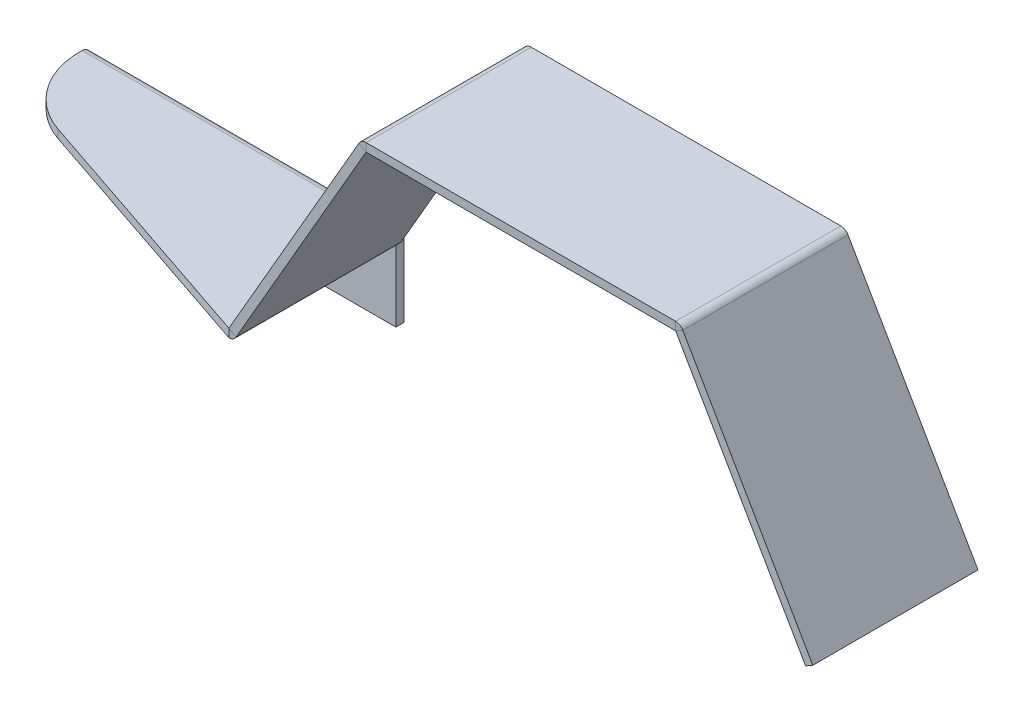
SolidWorks part; units mm, degrees
ref_plane "Front Plane" through (0, 0, 0) normal (0, 0, 1) x (1, 0, 0)
ref_plane "Top Plane" through (0, 0, 0) normal (0, 1, 0) x (1, 0, 0)
ref_plane "Right Plane" through (0, 0, 0) normal (1, 0, 0) x (0, 0, -1)
sketch "Sketch1" plane through (0, 0, 0) normal (0, 0, 1) x (1, 0, 0)
  line L0 (0, 0) -> (102, 0)
  line L1 (102, 0) -> (102, 20)
  line L2 (102, 20) -> (0, 20)
  line L3 (0, 0) -> (0, -10)
  line L4 (0, -10) -> (-28, -10)
  line L5 (-28, -10) -> (-28, 0) construction
  line L6 (0, 20) -> (-31.1966, 9.4753)
  line L7 (0, 0) -> (0, 20) construction
  line L8 (0, 0) -> (-28, 0) construction
  line L9 (0, -5) -> (-28, -5) construction
  arc A0 (-31.1966, 9.4753) -> (-28, -10) centre (-28, 0) ccw
  circle A1 centre (-8, -5) radius 1.75
  circle A2 centre (-28, -5) radius 1.75
  dimension "D3" = 10
  dimension "D5" = 8
  dimension "D6" = 3.5
  dimension "D1" = 20
  dimension "D2" = 102
  dimension "D4" = 28
sheet metal parameters "Sheet-Metal1" thickness 1 parameters "D1"=0.7366
base flange "Base-Flange1" sketch "Sketch1" thickness 1 reverse thickness direction no parameters "D1"=0.7366
sketch "Sketch3" plane through (0, 0, 0) normal (0, 0, 1) x (1, 0, 0)
  line L0 (0, 0) -> (-34.1727, 0)
sketched bend "Sketched Bend1" parameters "D1"=0.001
bend "SketchBend1" bend radius 0.001 bend angle 90 parameters "D5"=1
sketch "Sketch4" plane through (0, -1, 0) normal (0, -1, 0) x (-1, 0, 0)
  line L0 (0, -20.215) -> (0, 8.6421)
sketched bend "Sketched Bend3" parameters "D1"=0.001
bend "SketchBend3" bend radius 0.001 bend angle 60 parameters "D5"=2
sketch "Sketch6" plane through (0.0004, -0.0002, 0) normal (-0.866, 0.5, 0) x (0, 0, 1)
  line L0 (0.215, 69.4762) -> (20.215, 69.4762)
  line L1 (0.215, 0.0009) -> (0.215, 101.4762) construction
  line L2 (20.215, 101.4762) -> (20.215, 0.0009) construction
  line L3 (0.215, 31.4762) -> (20.215, 31.4762)
  line L4 (0.215, 101.4762) -> (20.215, 101.4762) construction
  dimension "D1" = 32
  dimension "D2" = 38
sketched bend "Sketched Bend5" parameters "D1"=0.001
bend "SketchBend6" bend radius 0.001 bend angle 60 parameters "D5"=3
bend "SketchBend7" bend radius 0.001 bend angle 60 parameters "D5"=4
flat pattern "Flat-Pattern1"
sketch "Bend-Lines1" plane through (0, 27.7595, 0) normal (0, 1, 0) x (-1, 0, 0)
  line L0 (-16.3431, 0.215) -> (-16.3431, 20.215) construction
  line L1 (-54.3431, 0.215) -> (-54.3431, 20.215) construction
  line L2 (15.6569, 0.215) -> (15.6569, 20.215) construction
  line L3 (53.9007, -0.3925) -> (15.9192, -0.3925) construction
sketch3d "Bounding-Box1" [suppressed]
  line L0 (-130, 20, 0) -> (9.9999, 19.9999, 0) construction
  line L1 (-130, -9.9999, 0) -> (9.9999, -10, 0) construction
  line L2 (-130, 20, 0) -> (-130, -9.9999, 0) construction
  line L3 (9.9999, 19.9999, 0) -> (9.9999, -10, 0) construction
